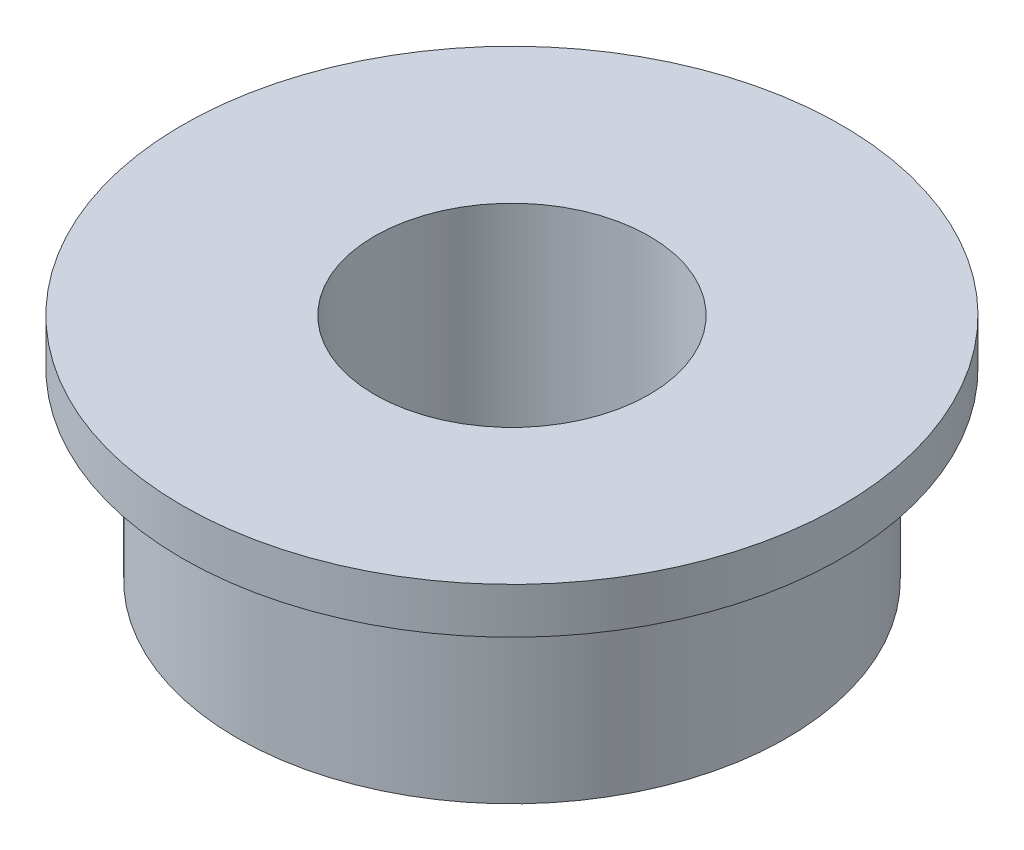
SolidWorks part; units mm, degrees
ref_plane "Front Plane" through (0, 0, 0) normal (0, 0, 1) x (1, 0, 0)
ref_plane "Top Plane" through (0, 0, 0) normal (0, 1, 0) x (1, 0, 0)
ref_plane "Right Plane" through (0, 0, 0) normal (1, 0, 0) x (0, 0, -1)
sketch "Sketch1" plane through (0, 0, 0) normal (0, 1, 0) x (1, 0, 0)
  circle A0 centre (0, 0) radius 1.5
  circle A1 centre (0, 0) radius 3
  dimension "D1" = 3
  dimension "D2" = 6
extrude "Boss-Extrude1" add sketch "Sketch1" along normal blind 2
sketch "Sketch2" plane through (0, 2, 0) normal (0, 1, 0) x (1, 0, 0)
  circle A0 centre (0, 0) radius 1.5
  circle A1 centre (0, 0) radius 3.6
  dimension "D1" = 7.2
extrude "Boss-Extrude2" add sketch "Sketch2" along normal blind 0.5
sketch "Sketch3" plane through (0, 0, 0) normal (0, -1, 0) x (1, 0, 0)
  circle A0 centre (0, 0) radius 2.7865
extrude "Cut-Extrude1" cut sketch "Sketch3" against normal blind 0.1
